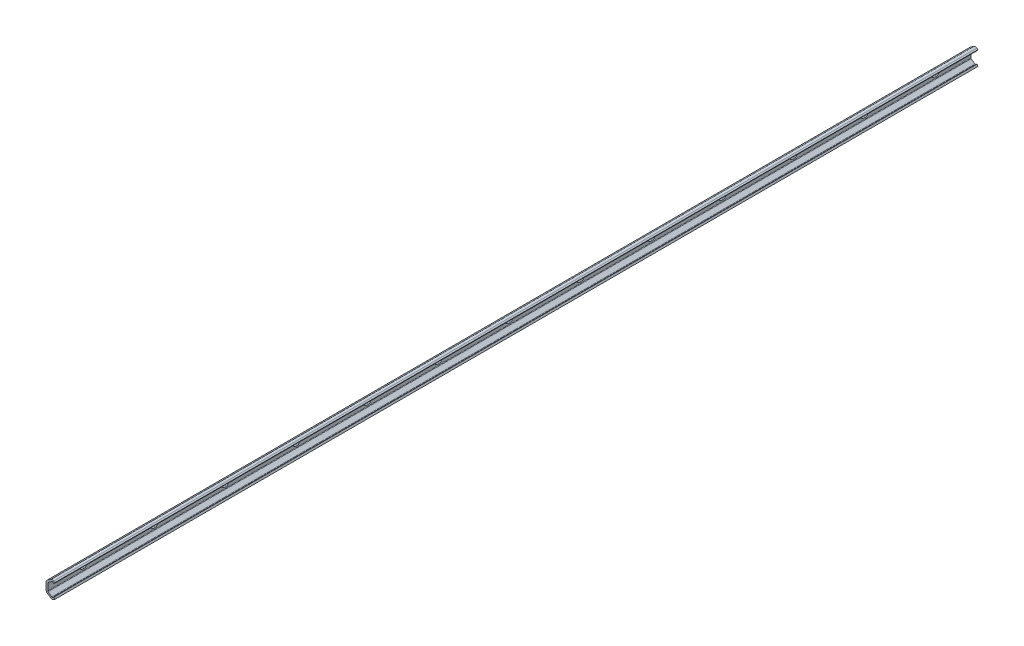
SolidWorks part; units mm, degrees
ref_plane "Front Plane" through (0, 0, 0) normal (0, 0, 1) x (1, 0, 0)
ref_plane "Top Plane" through (0, 0, 0) normal (0, 1, 0) x (1, 0, 0)
ref_plane "Right Plane" through (0, 0, 0) normal (1, 0, 0) x (0, 0, -1)
sketch "Sketch1" plane through (0, 0, 0) normal (0, 0, 1) x (1, 0, 0)
  line L0 (8.8528, 6.5211) -> (10, 8.1594)
  line L1 (10, 8.1594) -> (8.6321, 9.1172)
  line L2 (5.3679, 9.1172) -> (1.3827, 6.3267)
  line L3 (0, 3.8) -> (0, -3.8)
  line L4 (1.3827, -6.3267) -> (5.3679, -9.1172)
  line L5 (8.6321, -9.1172) -> (10, -8.1594)
  line L6 (10, -8.1594) -> (8.8528, -6.5211)
  line L7 (8.8528, -6.5211) -> (7.522, -7.453)
  line L8 (6.478, -7.453) -> (2.3691, -4.5758)
  line L9 (2, -3.8) -> (2, 3.8)
  line L10 (2.3691, 4.5758) -> (6.478, 7.453)
  line L12 (7.522, 7.453) -> (8.8528, 6.5211)
  arc A0 (8.6321, 9.1172) -> (5.3679, 9.1172) centre (7, 6.7863) ccw
  arc A1 (1.3827, 6.3267) -> (0, 3.8) centre (3.2464, 3.6652) ccw
  arc A2 (0, -3.8) -> (1.3827, -6.3267) centre (3, -3.8) ccw
  arc A3 (5.3679, -9.1172) -> (8.6321, -9.1172) centre (7, -6.7863) ccw
  arc A4 (7.522, -7.453) -> (6.478, -7.453) centre (7, -6.7075) cw
  arc A5 (2.3691, -4.5758) -> (2, -3.8) centre (2.8685, -3.8626) cw
  arc A6 (2, 3.8) -> (2.3691, 4.5758) centre (3, 3.8) cw
  arc A7 (6.478, 7.453) -> (7.522, 7.453) centre (7, 6.7075) cw
  dimension "D1" = 2.8455
  dimension "D2" = 3.2492
  dimension "D3" = 3
  dimension "D4" = 2.8455
  dimension "D5" = 0.91
  dimension "D6" = 0.8708
  dimension "D7" = 1
  dimension "D8" = 0.91
  dimension "D9" = 1.3827
  dimension "D10" = 1.3827
  dimension "D11" = 2
  dimension "D12" = 2.3691
  dimension "D13" = 2.8685
  dimension "D14" = 2.3691
  dimension "D15" = 3.2464
  dimension "D16" = 5.3679
  dimension "D17" = 3
  dimension "D18" = 5.3679
  dimension "D19" = 6.478
  dimension "D20" = 6.478
  dimension "D21" = 7
  dimension "D22" = 7.522
  dimension "D23" = 3.6652
  dimension "D24" = 3.8
  dimension "D31" = 8.8528
  dimension "D32" = 8.8528
  dimension "D33" = 10
  dimension "D34" = 10
extrude "Extrude1" add sketch "Sketch1" against normal blind 1040
sketch "Sketch2" plane through (2, 0, 0) normal (1, 0, 0) x (0, 0, -1)
  line L0 (38.75, 0) -> (41.25, 0) construction
  line L1 (38.75, 2.25) -> (41.25, 2.25)
  line L2 (38.75, -2.25) -> (41.25, -2.25)
  arc A0 (38.75, 2.25) -> (38.75, -2.25) centre (38.75, 0) ccw
  arc A1 (41.25, -2.25) -> (41.25, 2.25) centre (41.25, 0) ccw
  point P6 (40, 0)
  dimension "D1" = 2.5
  dimension "D2" = 4.5
  dimension "D3" = 40
extrude "Extrude2" cut sketch "Sketch2" against normal through all
pattern_linear "LPattern1" count 13 spacing 80 along (0, 0, -1) of "Extrude2"
